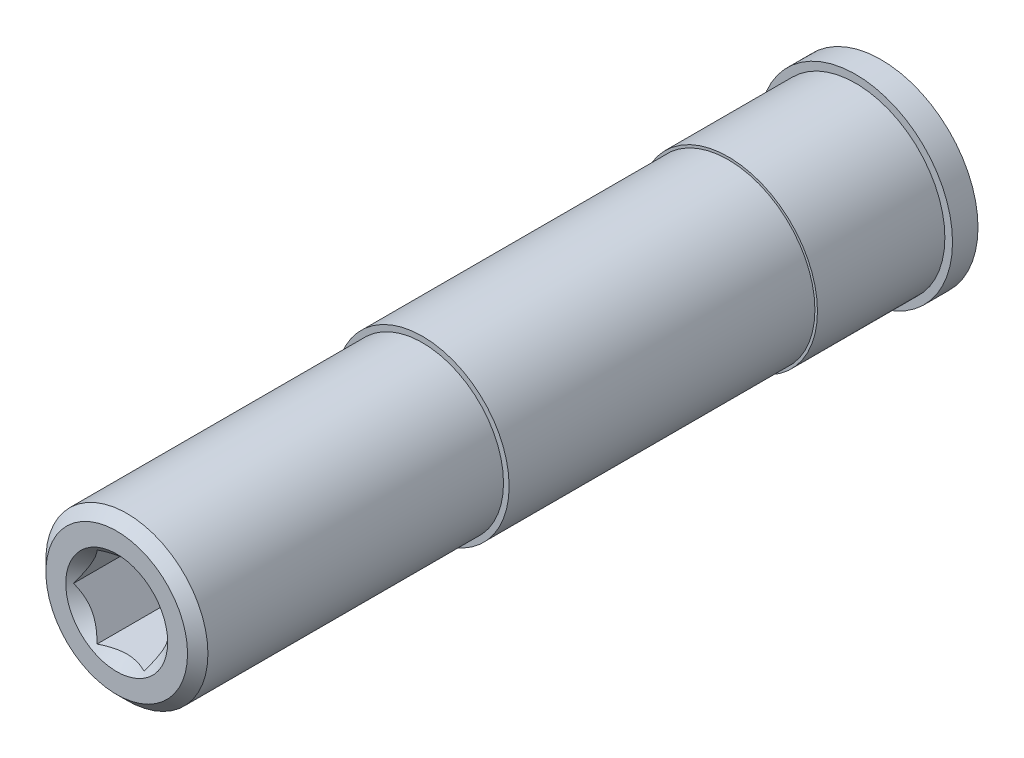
SolidWorks part; units mm, degrees
ref_plane "Face" through (0, 0, 0) normal (0, 0, 1) x (1, 0, 0)
ref_plane "Dessus" through (0, 0, 0) normal (0, 1, 0) x (1, 0, 0)
ref_plane "Droite" through (0, 0, 0) normal (1, 0, 0) x (0, 0, -1)
sketch "Esquisse1" plane through (0, 0, 0) normal (0, 0, 1) x (1, 0, 0)
  circle A0 centre (0, 0) radius 9.5
  dimension "D1" = 19
extrude "Extrusion1" add sketch "Esquisse1" along normal blind 2.5
sketch "Esquisse2" plane through (0, 0, 2.5) normal (0, 0, 1) x (1, 0, 0)
  circle A0 centre (0, 0) radius 8.75
  dimension "D1" = 17.5
extrude "Extrusion2" add sketch "Esquisse2" along normal blind 12.5
sketch "Esquisse3" plane through (0, 0, 15) normal (0, 0, 1) x (1, 0, 0)
  circle A0 centre (0, 0) radius 8.5
  dimension "D1" = 17
extrude "Extrusion3" add sketch "Esquisse3" along normal blind 30
sketch "Esquisse4" plane through (0, 0, 45) normal (0, 0, 1) x (1, 0, 0)
  circle A0 centre (0, 0) radius 7.95
  dimension "D1" = 15.9
extrude "Extrusion4" add sketch "Esquisse4" along normal blind 30
chamfer "Chanfrein1" distance 1 angle 45 1 edges at (7.95, 0, 75)
sketch "Esquisse6" plane through (0, 0, 75) normal (0, 0, 1) x (1, 0, 0)
  circle A0 centre (0, 0) radius 4
  dimension "D1" = 8
extrude "Enlèv. mat.-Extru.2" cut sketch "Esquisse6" against normal blind 1
chamfer "Chanfrein2" distance 1 angle 45 1 edges at (4, 0, 75)
sketch "Esquisse5" plane through (0, 0, 75) normal (0, 0, 1) x (1, 0, 0)
  line L1 (4.6188, 0) -> (2.3094, 4)
  line L2 (2.3094, 4) -> (-2.3094, 4)
  line L3 (-2.3094, 4) -> (-4.6188, 0)
  line L4 (-4.6188, 0) -> (-2.3094, -4)
  line L5 (-2.3094, -4) -> (2.3094, -4)
  line L6 (2.3094, -4) -> (4.6188, 0)
  circle A0 centre (0, 0) radius 4 construction
  dimension "D1" = 8
extrude "Enlèv. mat.-Extru.1" cut sketch "Esquisse5" against normal blind 9
